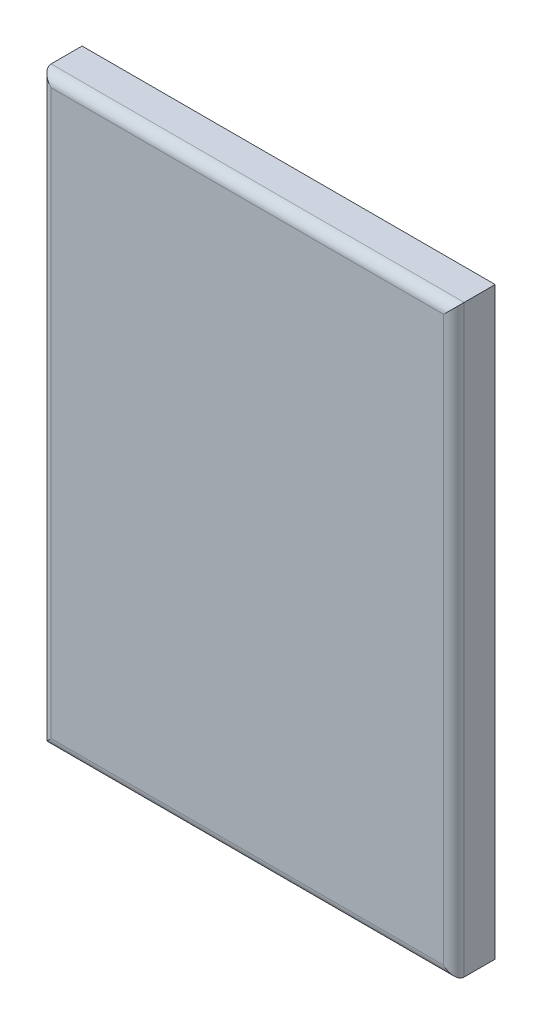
SolidWorks part; units mm, degrees
ref_plane "Alzado" through (0, 0, 0) normal (0, 0, 1) x (1, 0, 0)
ref_plane "Planta" through (0, 0, 0) normal (0, 1, 0) x (1, 0, 0)
ref_plane "Vista lateral" through (0, 0, 0) normal (1, 0, 0) x (0, 0, -1)
sketch "Croquis1" plane through (0, 0, 0) normal (0, 0, 1) x (1, 0, 0)
  line L1 (40, 0) -> (0, 0)
  line L2 (40, 0) -> (40, 56.57)
  line L3 (40, 56.57) -> (0, 56.57)
  line L4 (0, 0) -> (0, 56.57)
extrude "Extruir1" add sketch "Croquis1" along normal blind 4
fillet "Redondeo1" radius 1 4 edges at (20, 0, 4) (0, 28.285, 4) (20, 56.57, 4) (40, 28.285, 4)
